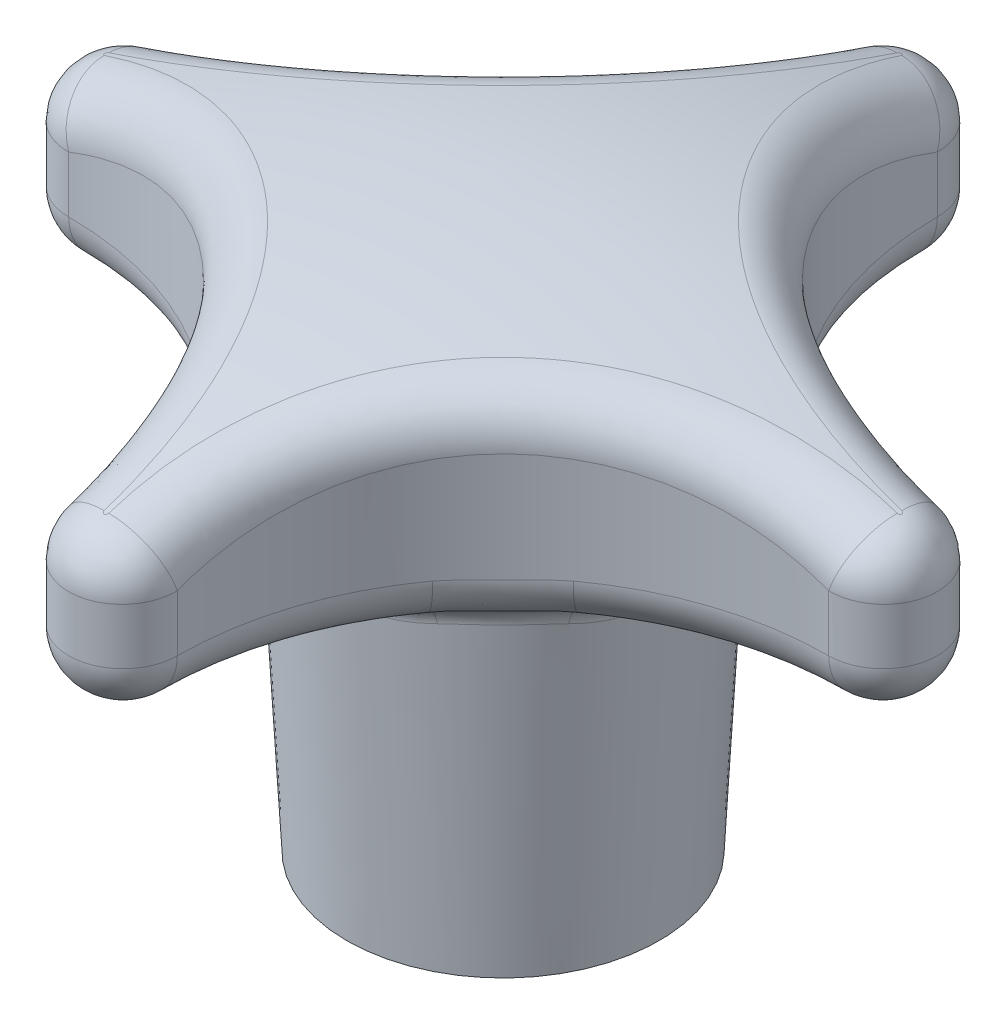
SolidWorks part; units mm, degrees
ref_plane "Front Plane" through (0, 0, 0) normal (0, 0, 1) x (1, 0, 0)
ref_plane "Top Plane" through (0, 0, 0) normal (0, 1, 0) x (1, 0, 0)
ref_plane "Right Plane" through (0, 0, 0) normal (1, 0, 0) x (0, 0, -1)
sketch "Sketch1" plane through (0, 0, 0) normal (0, 1, 0) x (1, 0, 0)
  circle A0 centre (0, 0) radius 9
  dimension "D1" = 18
extrude "Extrude1" add sketch "Sketch1" against normal blind 19.2
draft "Draft1" type of draft neutral plane draft angle 3 faces to draft 1 parameters "D1"=3
sketch "Sketch2" plane through (0, 0, 0) normal (0, 0, 1) x (1, 0, 0)
  line L0 (0, 0) -> (-25, 0)
  line L1 (-25, 0) -> (-25, 8.32)
  line L2 (0, 0) -> (0, 50000) construction
  line L3 (0, 12.8) -> (20.2547, 12.8) construction
  line L4 (0, 0) -> (0, 12.8)
  arc A0 (0, 12.8) -> (-25, 8.32) centre (0, -59.1945) ccw
revolve "Revolve1" add sketch "Sketch2" angle 360 about L2
sketch "Sketch4" plane through (0, 0, 0) normal (0, 1, 0) x (1, 0, 0)
  line L0 (0, 0) -> (-50000, 0) construction
  line L1 (0, 0) -> (0, 50000) construction
  line L2 (-21.875, 3.125) -> (-45.9117, 3.125) construction
  line L3 (-3.125, 21.875) -> (-3.125, 40.3224) construction
  arc A0 (0, 25) -> (-3.125, 21.875) centre (0, 21.875) ccw
  arc A1 (-21.875, 3.125) -> (-25, 0) centre (-21.875, 0) ccw
  circle A2 centre (0, 0) radius 25 construction
  arc A3 (-21.875, 3.125) -> (-3.125, 21.875) centre (-21.875, 21.875) ccw
  arc A4 (0, 25) -> (-25, 0) centre (-25, 25) ccw
  point P9 (0, 25)
  point P10 (-25, 0)
  point P13 (-3.125, 21.875)
  point P14 (-21.875, 3.125)
extrude "Extrude3" cut sketch "Sketch4" along normal through all
pattern_circular "CirPattern1" count 4 over 360 about axis through (0, 0, 0) along (0, 1, 0) of "Extrude3"
fillet "Fillet2" radius 3 16 edges at (0, 0, 25) (8.6167, 0, 8.6167) (25, 0, 0) (8.6167, 0, -8.6167) (0, 0, -25) (-8.6167, 0, -8.6167) (-25, 0, 0) (-0.0002, 8.32, 25) (10.5247, 11.6866, 6.9508) (25, 8.32, 0.0002) (6.9508, 11.6866, -10.5247) (0.0002, 8.32, -25) (-10.5247, 11.6866, -6.9508) (-25, 8.32, 0.0002) (-8.6167, 0, 8.6167) (-6.9508, 11.6866, 10.5247)
fillet "Fillet3" radius 1.5 8 edges at (-7.0755, 0, -7.0755) (0, 0, -10.0062) (7.0755, 0, -7.0755) (10.0062, 0, 0) (7.0755, 0, 7.0755) (0, 0, 10.0062) (-7.0755, 0, 7.0755) (-10.0062, 0, 0)
sketch "Sketch6" [suppressed] plane through (0, -30, 0) normal (0, -1, 0) x (1, 0, 0)
  circle A0 centre (0, 0) radius 8
  dimension "D1" = 8
extrude "Extrude5" [suppressed] cut sketch "Sketch6" against normal blind 18
sketch "Sketch7" [suppressed] plane through (0, 0, 0) normal (0, 0, 1) x (1, 0, 0)
  line L0 (0, 2) -> (8, 2)
  line L1 (8, -30) -> (8, 2) construction
  line L2 (8, 2) -> (0, 6.6188)
  line L3 (0, 6.6188) -> (0, 2)
  line L4 (-8, -30) -> (8, -30) construction
revolve "Cut-Revolve1" [suppressed] cut sketch "Sketch7" angle 360 about L3
sketch "Sketch8" [suppressed] plane through (0, -24, 0) normal (0, -1, 0) x (1, 0, 0)
  circle A0 centre (0, 0) radius 6
  dimension "D1" = 10
extrude "Extrude6" [suppressed] cut sketch "Sketch8" against normal blind 20
sketch "Sketch9" [suppressed] plane through (0, -4, 0) normal (0, -1, 0) x (1, 0, 0)
  circle A0 centre (0, 0) radius 6.5
  dimension "D1" = 8.4
extrude "Extrude7" [suppressed] cut sketch "Sketch9" against normal through all
sketch "Sketch10" plane through (0, -19.2, 0) normal (0, -1, 0) x (1, 0, 0)
  circle A0 centre (0, 0) radius 5
extrude "Extrude8" cut sketch "Sketch10" against normal blind 18
sketch "Sketch11" plane through (0, 0, 0) normal (0, 0, 1) x (1, 0, 0)
  line L0 (4.25, 6.3463) -> (4.25, -1.2)
  line L1 (0, 0) -> (0, -5.4531) construction
  line L2 (4.25, 6.3463) -> (0, 8.8)
  line L3 (0, 8.8) -> (0, -1.2)
  line L4 (-5, -1.2) -> (5, -1.2) construction
  line L5 (4.25, -1.2) -> (0, -1.2)
revolve "Cut-Revolve2" cut sketch "Sketch11" angle 360 about L3
equation "\"D2@Sketch2\" = \"D1@Sketch2\"*.65"
equation "\"D1@Sketch4\" = (\"D3@Sketch2\"*2)/8"
equation "\"D2@Sketch4\" =( \"D3@Sketch2\"*2)/8"
equation "\"D1@Sketch7\" = \"D1@Extrude5\""
equation "\"D1@Fillet3\" = \"D1@Fillet2\"/2"
equation "\"D2@Sketch11\" = \"D1@Sketch10\""
